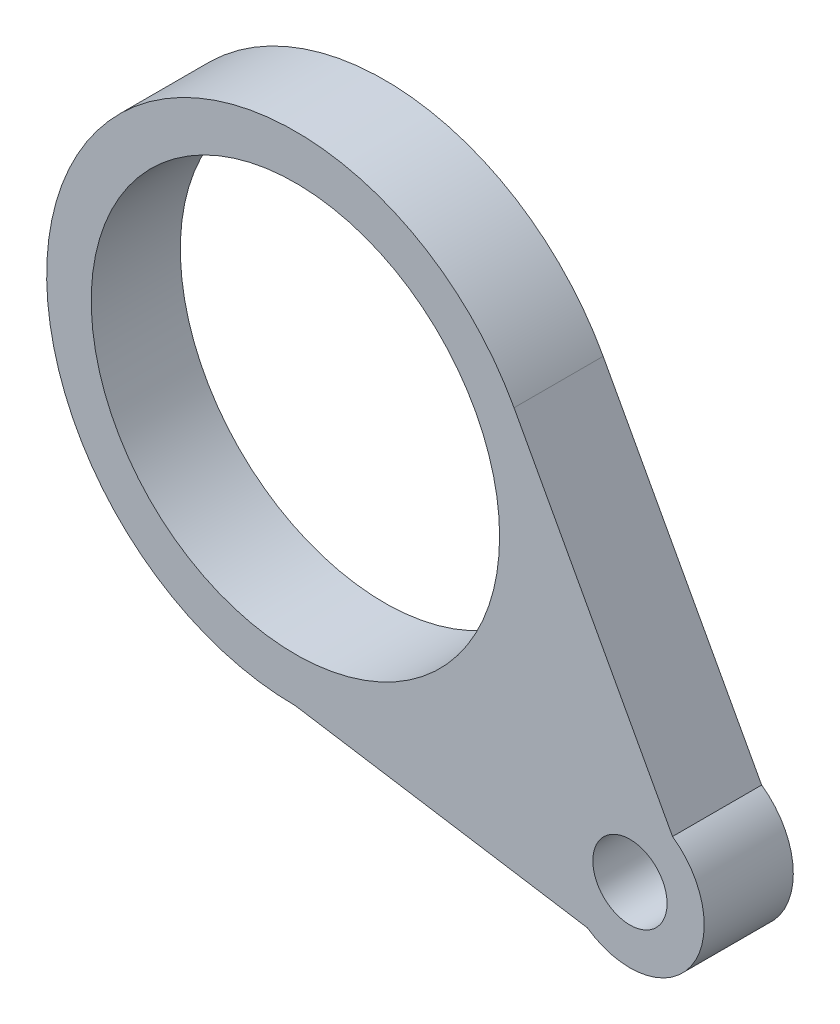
SolidWorks part; units mm, degrees
ref_plane "Front Plane" through (0, 0, 0) normal (0, 0, 1) x (1, 0, 0)
ref_plane "Top Plane" through (0, 0, 0) normal (0, 1, 0) x (1, 0, 0)
ref_plane "Right Plane" through (0, 0, 0) normal (1, 0, 0) x (0, 0, -1)
sketch "Sketch1" plane through (0, 0, 0) normal (0, 0, 1) x (1, 0, 0)
  line L0 (0, 0) -> (59.9454, -41.9742) construction
  line L1 (0, 0) -> (115.7946, 0) construction
  line L2 (4.164, -89.9428) -> (85.9428, 26.8494) construction
  line L3 (50.7891, -23.3552) -> (29.4439, 15.9784)
  line L4 (39.3176, -39.7382) -> (0, -33.5)
  circle A0 centre (0, 0) radius 27.5
  circle A1 centre (0, 0) radius 33.5
  circle A2 centre (45.0534, -31.5467) radius 10
  circle A3 centre (45.0534, -31.5467) radius 5
  point P11 (45.0534, -31.5467)
  dimension "D2" = 55
  dimension "D4" = 20
  dimension "D6" = 10
  dimension "D3" = 35
  dimension "D5" = 55
  dimension "D1" = 6
extrude "Boss-Extrude1" add sketch "Sketch1" along normal blind 12 contours A1 A0 | A2 L3 A1 L4 | A2
sketch "Sketch3" plane through (0, 0, 0) normal (0, 0, -1) x (-1, 0, 0)
  circle A0 centre (-30.5164, -27.8483) radius 1.5
  circle A1 centre (-45.0534, -31.5467) radius 5 construction
  dimension "D1" = 3
  dimension "D2" = 15
extrude "Boss-Extrude3" add sketch "Sketch3" along normal blind 5
